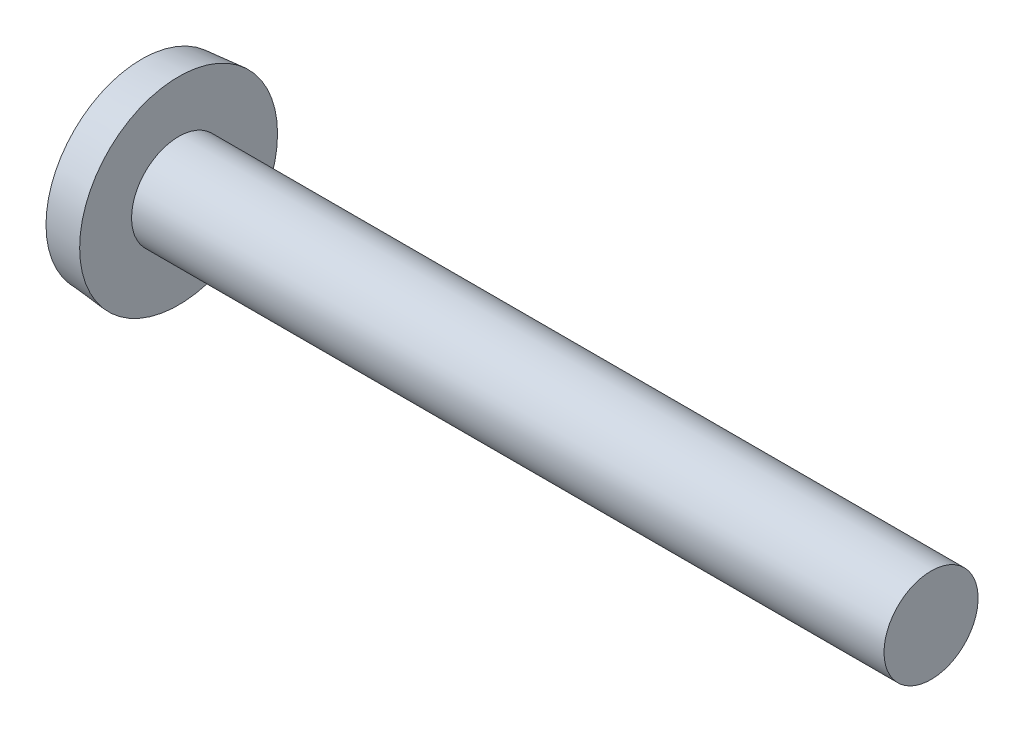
SolidWorks part; units mm, degrees
ref_plane "Plane1" through (0, 0, 0) normal (0, 0, 1) x (1, 0, 0)
ref_plane "Plane2" through (0, 0, 0) normal (0, 1, 0) x (1, 0, 0)
ref_plane "Plane3" through (0, 0, 0) normal (1, 0, 0) x (0, 0, -1)
revolve "Base-Revolve" add sketch "BodySke" angle 360 about L2
sketch "BodySke" plane through (0, 0, 0) normal (0, 0, 1) x (1, 0, 0)
  line L0 (1.9812, 1.5875) -> (1.9812, 3.3401)
  line L1 (1.9812, 3.3401) -> (0.7366, 3.2312)
  line L2 (-25.4, 0) -> (127, 0) construction
  line L3 (1.9812, -3.3401) -> (0.7366, -3.2312) construction
  line L4 (1.9812, 1.5875) -> (27.3812, 1.5875)
  line L5 (27.3812, 1.5875) -> (27.3812, 0)
  line L6 (27.3812, 0) -> (0, 0)
  line L7 (1.9812, -1.5875) -> (27.3812, -1.5875) construction
  line L8 (2.5578, 6.35) -> (2.5578, -3.175) construction
  line L9 (1.9812, 6.35) -> (1.9812, -3.175) construction
  arc A0 (0, 0) -> (0.7366, 3.2312) centre (7.4554, 0) cw
  dimension "Head_ang" = 85
  dimension "Oval_ht" = 0.7366
  dimension "Head_ht" = 1.9812
  dimension "Diameter" = 3.175
  dimension "Length" = 25.4
  dimension "Head_dia" = 6.6802
  dimension "Advance" = 0.5766
  dimension "Thread_nom" = 25.4
sketch "Sketch2" plane through (0, 0, 0) normal (1, 0, 0) x (0, 0, -1)
  line L0 (3.3401, -0.5461) -> (3.3401, 0.5461)
  line L1 (3.3401, 0.5461) -> (-3.3401, 0.5461)
  line L2 (-3.3401, 0.5461) -> (-3.3401, -0.5461)
  line L3 (-3.3401, -0.5461) -> (3.3401, -0.5461)
  dimension "D1" = 6.6802
  dimension "D2" = 3.3401
  dimension "D3" = 0.5461
  dimension "Slot_width" = 1.0922
extrude "Slot" [suppressed] cut sketch "Sketch2" along normal blind 1.2192
sketch "Sketch3" plane through (0, 0, 0) normal (1, 0, 0) x (0, 0, -1)
  line L0 (-0.4572, 2.1844) -> (0.4572, 2.1844)
  line L1 (0.4572, 2.1844) -> (0.4572, -2.1844)
  line L2 (0.4572, -2.1844) -> (-0.4572, -2.1844)
  line L3 (-0.4572, -2.1844) -> (-0.4572, 2.1844)
  dimension "D1" = 0.4572
  dimension "Cross_width" = 0.9144
  dimension "D2" = 2.1844
  dimension "Cross_dia" = 4.3688
ref_plane "Plane4" through (2.4892, 0, 0) normal (1, 0, 0) x (0, 0, -1)
sketch "Sketch4" plane through (2.4892, 0, 0) normal (1, 0, 0) x (0, 0, -1)
  line L0 (-0.2286, 0.2286) -> (0.2286, 0.2286)
  line L1 (0.2286, 0.2286) -> (0.2286, -0.2286)
  line L2 (0.2286, -0.2286) -> (-0.2286, -0.2286)
  line L3 (-0.2286, -0.2286) -> (-0.2286, 0.2286)
  dimension "D1" = 0.4572
  dimension "D2" = 0.2286
  dimension "D3" = 0.4572
  dimension "D4" = 0.2286
loft "Cross" cut profiles "Sketch3", "Sketch4"
pattern_circular "CirPattern1" count 2 every 90 about axis through (0, 0, 0) along (1, 0, 0) of "Cross"
sketch "ThdSchSke" plane through (0, 0, 0) normal (0, 0, 1) x (1, 0, 0)
  line L0 (2.5578, -1.2433) -> (2.3168, -1.5875)
  line L1 (2.5578, -1.2433) -> (2.7988, -1.5875)
  line L2 (2.7988, -1.5875) -> (2.7988, -1.9844)
  line L3 (-3.175, 0) -> (5.1513, 0) construction
  line L5 (2.7988, -1.9844) -> (2.3168, -1.9844)
  line L6 (2.3168, -1.9844) -> (2.3168, -1.5875)
  dimension "Thread_minor" = 2.4867
  dimension "Diameter" = 3.175
  dimension "Start" = 2.5578
  dimension "SideAngle" = 55
  dimension "VeeAngle" = 70
  dimension "Overcut" = 3.9688
revolve "ThreadSchematic" [suppressed] cut sketch "ThdSchSke" angle 360 about L3
pattern_linear "ThdSchPat" [suppressed]
equation "\"D1@Sketch3\" = \"Cross_width@Sketch3\" / 2"
equation "\"D2@Sketch3\" = \"Cross_dia@Sketch3\" / 2"
equation "\"D1@Sketch4\" = \"Cross_width@Sketch3\"*.5"
equation "\"D2@Sketch4\" = \"D1@Sketch4\" / 2"
equation "\"D3@Sketch4\" = \"D1@Sketch4\""
equation "\"D4@Sketch4\" = \"D2@Sketch4\""
equation "\"D1@Sketch2\" = \"Head_dia@BodySke\""
equation "\"D2@Sketch2\" = \"D1@Sketch2\" / 2"
equation "\"D3@Sketch2\" = \"Slot_width@Sketch2\" / 2"
equation "\"Thread_length@ThreadCosmetic\" = ((sgn( (\"Length@BodySke\" - \"Advance@BodySke\" ) - \"Thread_nom@BodySke\" )-1)*( (\"Length@BodySke\" - \"Advance@BodySke\" ) - \"Thread_nom@BodySke\" ))/-2+ \"Thread_nom@BodySke\""
equation "\"Thread_minor@ThdSchSke\" = \"Thread_minor@ThreadCosmetic\""
equation "\"Diameter@ThdSchSke\" = \"Diameter@BodySke\""
equation "\"Overcut@ThdSchSke\" = \"Diameter@BodySke\" * 1.25"
equation "\"Start@ThdSchSke\" = \"Head_ht@BodySke\" + \"Length@BodySke\" - \"Thread_length@ThreadCosmetic\"  '---Non-countersunk---"
equation "\"Num_threads@ThdSchPat\" = int( \"Thread_length@ThreadCosmetic\" / \"Advance@BodySke\" + 0.999 )  + 1"
equation "\"Advance@ThdSchPat\" = \"Thread_length@ThreadCosmetic\" /  (\"Num_threads@ThdSchPat\" - 1) 'relax it"
